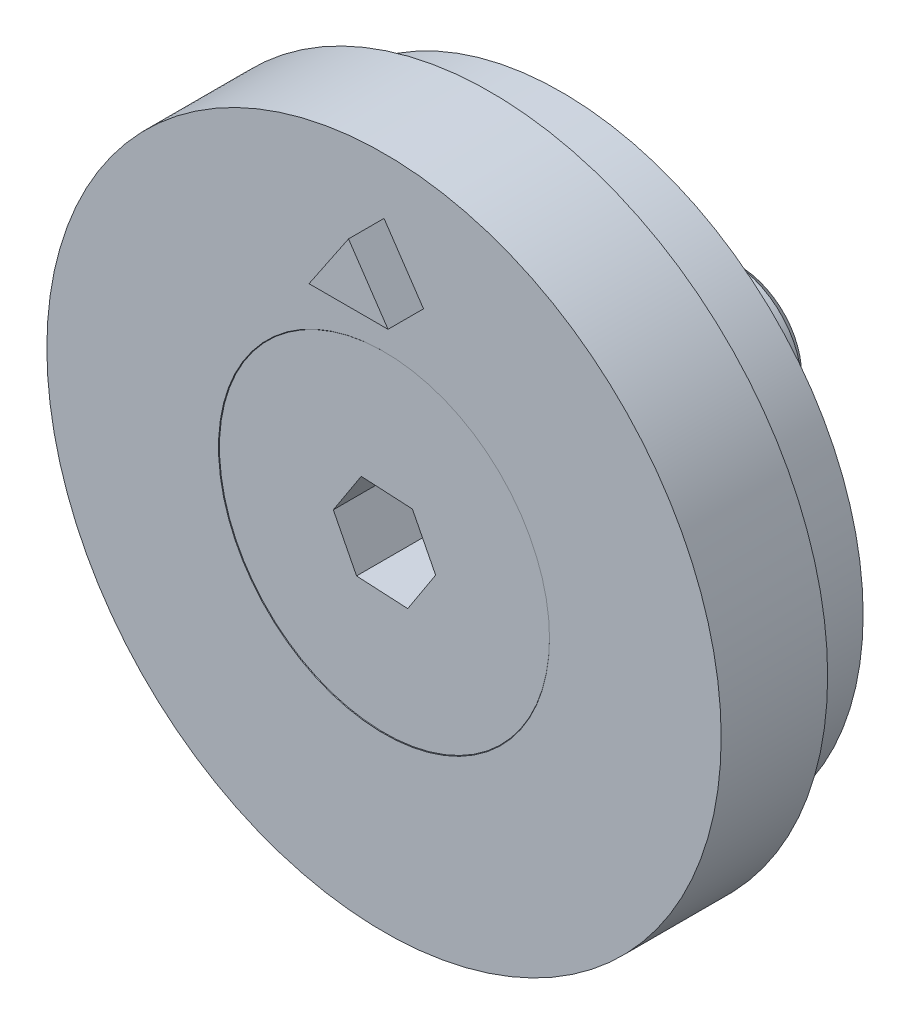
SolidWorks part; units mm, degrees
other "<M4 X .7 FHCS>-<Imported1>"
ref_plane "Front Plane" through (0, 0, 0) normal (0, 0, 1) x (1, 0, 0)
ref_plane "Top Plane" through (0, 0, 0) normal (0, 1, 0) x (1, 0, 0)
ref_plane "Right Plane" through (0, 0, 0) normal (1, 0, 0) x (0, 0, -1)
imported_body "Imported1"
inserted part "M4 X .7 FHCS"
move or copy body "Body-Move/Copy2" placed by mates yes
